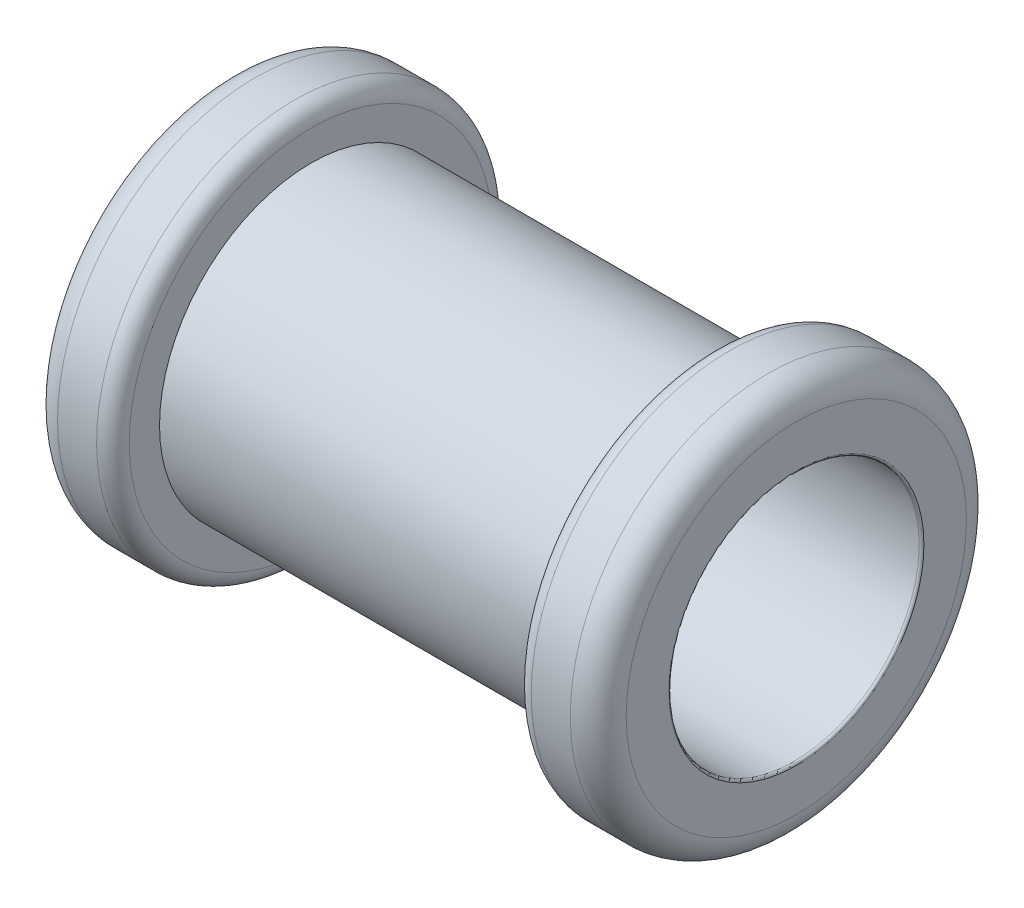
SolidWorks part; units mm, degrees
ref_plane "Face" through (0, 0, 0) normal (0, 0, 1) x (1, 0, 0)
ref_plane "Dessus" through (0, 0, 0) normal (0, 1, 0) x (1, 0, 0)
ref_plane "Droite" through (0, 0, 0) normal (1, 0, 0) x (0, 0, -1)
sketch "Esquisse1" plane through (0, 0, 0) normal (0, 0, 1) x (1, 0, 0)
  line L0 (-42.5369, 0) -> (73.8798, 0) construction
  line L1 (11.2879, 10.75) -> (-12.9121, 10.75)
  line L2 (-13.1121, 10.95) -> (-13.1121, 14.6)
  line L3 (-10.7121, 17) -> (-7.3621, 17)
  line L4 (-5.9621, 15.6) -> (-5.9621, 13)
  line L6 (-5.9621, 13) -> (11.2879, 13)
  line L7 (11.2879, 13) -> (11.2879, 10.75)
  arc A0 (-13.1121, 14.6) -> (-10.7121, 17) centre (-10.7121, 14.6) cw
  arc A1 (-12.9121, 10.75) -> (-13.1121, 10.95) centre (-12.9121, 10.95) cw
  arc A2 (-7.3621, 17) -> (-5.9621, 15.6) centre (-7.3621, 15.6) cw
  point P12 (-13.1121, 17)
  point P15 (-13.1121, 10.75)
  point P18 (-5.9621, 17)
  dimension "D1" = 10.75
  dimension "D5" = 2.4
  dimension "D6" = 0.2
  dimension "D7" = 1.4
  dimension "D2" = 2.25
  dimension "D3" = 6.25
  dimension "D4" = 7.15
  dimension "D8" = 17.25
revolve "Révolution1" add sketch "Esquisse1" angle 360 about L0
mirror "Symétrie1"
